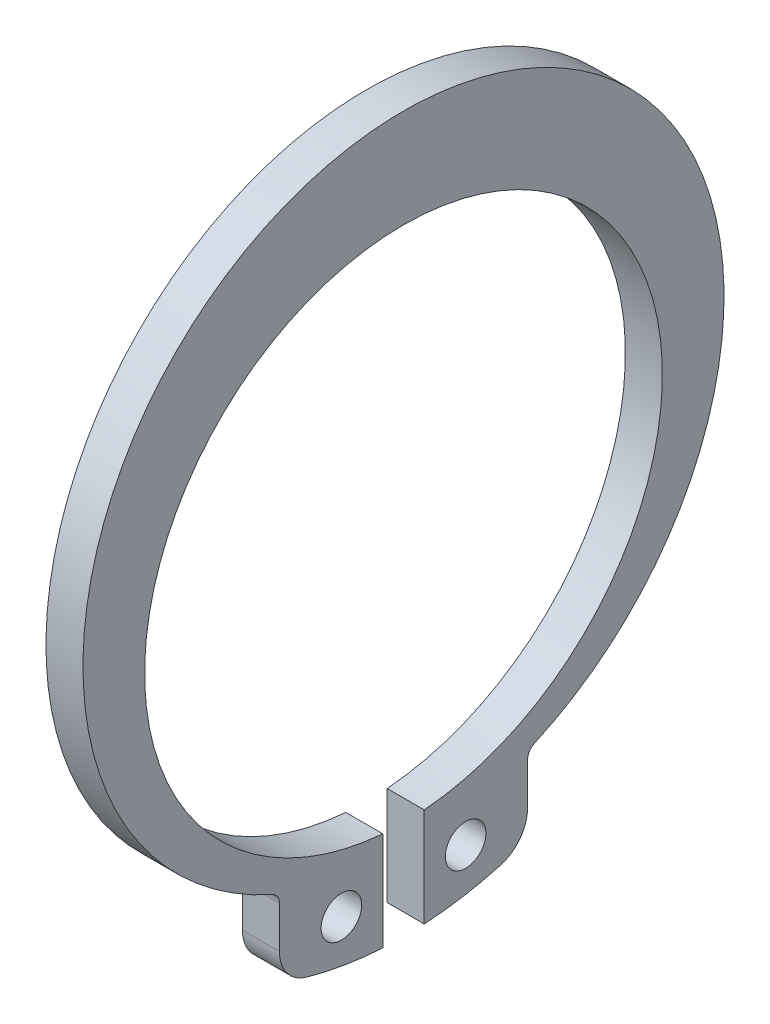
SolidWorks part; units mm, degrees
ref_plane "frontal" through (0, 0, 0) normal (0, 0, 1) x (1, 0, 0)
ref_plane "horizontal" through (0, 0, 0) normal (0, 1, 0) x (1, 0, 0)
ref_plane "profil" through (0, 0, 0) normal (1, 0, 0) x (0, 0, -1)
sketch "Esquisse1" plane through (0, 0, 0) normal (1, 0, 0) x (0, 0, -1)
  line L0 (0.84, -10.4663) -> (0.84, -14.4756)
  line L1 (5.0293, -10.8157) -> (5.0293, -12.5117)
  line L2 (0, -11) -> (0, -19) construction
  line L3 (-5.0293, -10.8157) -> (-5.0293, -12.5117)
  line L4 (-0.84, -10.4663) -> (-0.84, -14.4756)
  arc A0 (0.84, -10.4663) -> (-0.84, -10.4663) centre (0, 0) ccw
  arc A2 (0.84, -14.4756) -> (3.9366, -13.9554) centre (0, 0) ccw
  arc A3 (5.3245, -10.3596) -> (-5.3245, -10.3596) centre (0, 1.5) ccw
  arc A4 (5.0293, -12.5117) -> (3.9366, -13.9554) centre (3.5293, -12.5117) cw
  arc A5 (5.0293, -10.8157) -> (5.3245, -10.3596) centre (5.5293, -10.8157) cw
  circle A6 centre (2.5187, -12.5379) radius 0.8231
  circle A7 centre (-2.5187, -12.5379) radius 0.8231
  arc A8 (-5.0293, -12.5117) -> (-3.9366, -13.9554) centre (-3.5293, -12.5117) ccw
  arc A9 (-0.84, -14.4756) -> (-3.9366, -13.9554) centre (0, 0) cw
  arc A10 (-5.0293, -10.8157) -> (-5.3245, -10.3596) centre (-5.5293, -10.8157) ccw
  dimension "D1" = 21
  dimension "D3" = 1.5
  dimension "D4" = 0.5
  dimension "D5" = 1.5
  dimension "D6" = 13
  dimension "D7" = 14.5
extrude "Base-Extrusion" add sketch "Esquisse1" along normal blind 1.5
